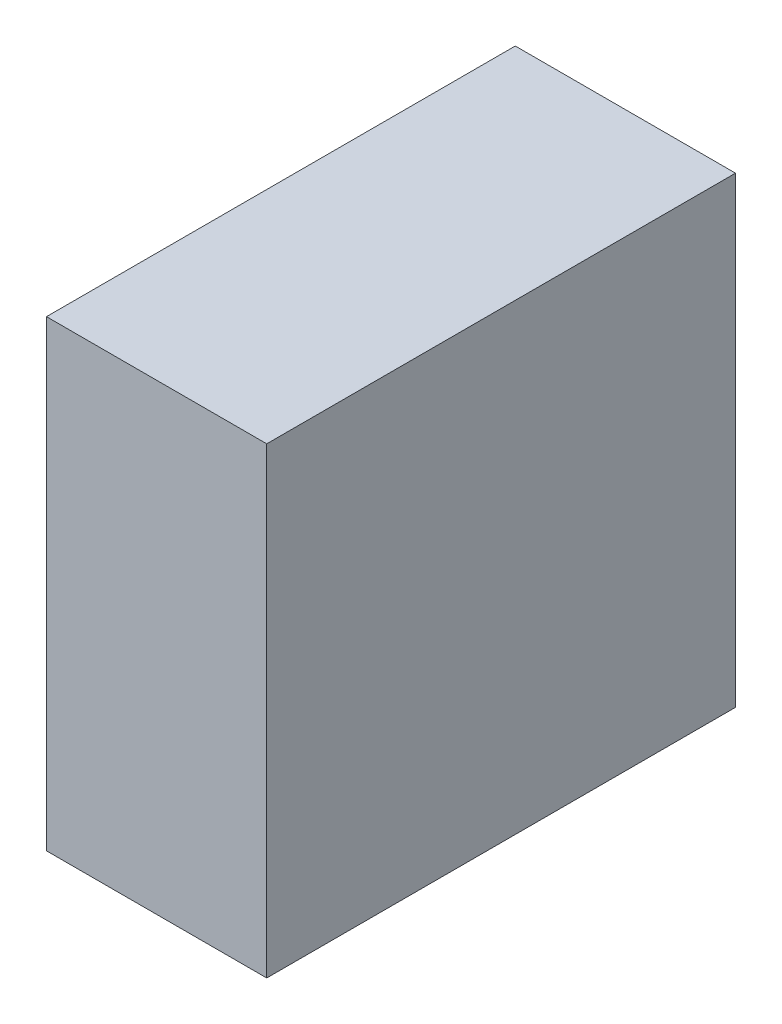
SolidWorks part; units mm, degrees
ref_plane "Front Plane" through (0, 0, 0) normal (0, 0, 1) x (1, 0, 0)
ref_plane "Top Plane" through (0, 0, 0) normal (0, 1, 0) x (1, 0, 0)
ref_plane "Right Plane" through (0, 0, 0) normal (1, 0, 0) x (0, 0, -1)
sketch "Sketch1" plane through (0, 0, 0) normal (0, 1, 0) x (1, 0, 0)
  line L1 (0, 0) -> (35.8, 0)
  line L2 (0, 0) -> (0, 76.2)
  line L3 (0, 76.2) -> (35.8, 76.2)
  line L4 (35.8, 0) -> (35.8, 76.2)
  dimension "D1" = 76.2
  dimension "D2" = 35.8
extrude "Boss-Extrude1" add sketch "Sketch1" along normal blind 75.2
